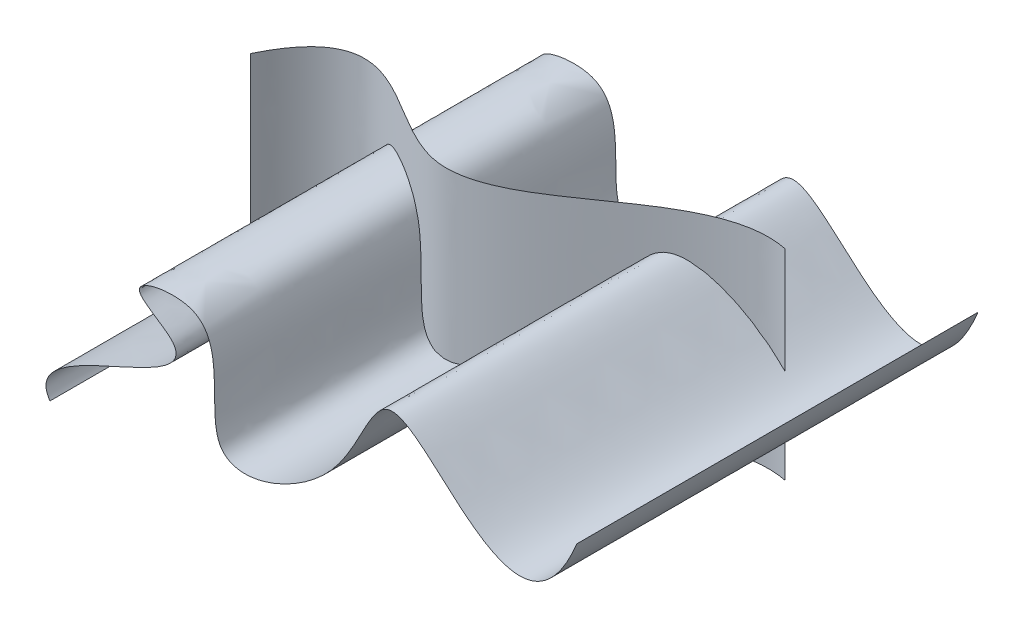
SolidWorks part; units mm, degrees
ref_plane "Vorne" through (0, 0, 0) normal (0, 0, 1) x (1, 0, 0)
ref_plane "Oben" through (0, 0, 0) normal (0, 1, 0) x (1, 0, 0)
ref_plane "Rechts" through (0, 0, 0) normal (1, 0, 0) x (0, 0, -1)
sketch "Skizze1" plane through (0, 0, 0) normal (0, 1, 0) x (1, 0, 0)
  spline S0 degree 3 poles (0, 0) (13.5993, 27.9842) (51.2533, -29.4405) (85.5892, 29.2456) (108.7466, 24.4788) knots 0 0 0 0 0.434694 1 1 1 1
surface "Oberfläche-Linear austragen1" sketch "Skizze1" parameters "D1"=50
sketch "Skizze2" plane through (0, 0, 0) normal (0, 0, 1) x (1, 0, 0)
  spline S0 degree 3 poles (0, 0) (-8.3248, 11.9849) (50.9841, 20.7286) (15.4343, 36.1414) (47.4337, 42.4395) (32.3867, -0.728) (74.7453, 15.6116) (84.5189, 62.3391) (116.8619, -0.4485) (131.315, 34.8163) knots 0 0 0 0 0.210732 0.264608 0.329182 0.467888 0.616508 0.740177 1 1 1 1
surface "Oberfläche-Linear austragen2" sketch "Skizze2" parameters "D1"=50, "D2"=50
sketch3d "3D-Skizze1"
  spline S0 degree 3 number of poles 214 (108.7466, 23.5044, -24.4788) -> (0, 5.6779, 0)
  spline S1 degree 3 number of poles 214 (108.7466, 23.5044, -24.4788) -> (0, 5.6779, 0)
